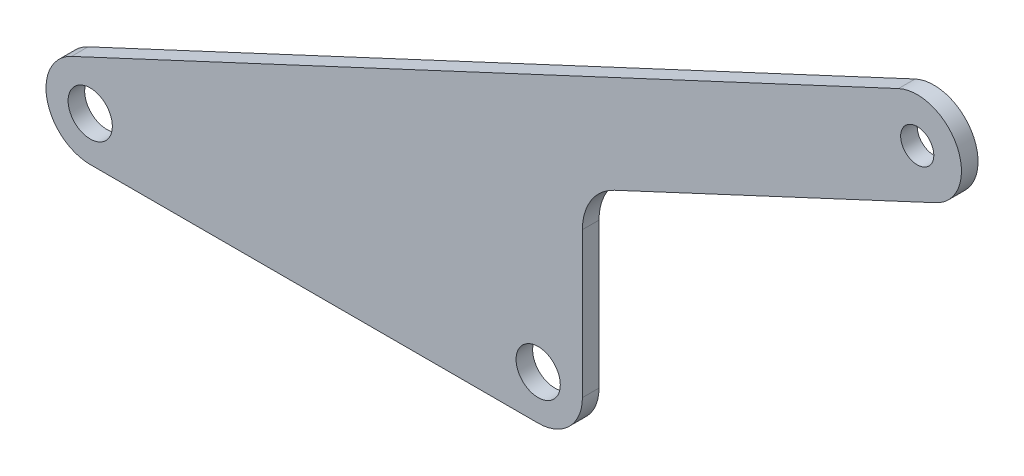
SolidWorks part; units mm, degrees
ref_plane "Plan de face" through (0, 0, 0) normal (0, 0, 1) x (1, 0, 0)
ref_plane "Plan de dessus" through (0, 0, 0) normal (0, 1, 0) x (1, 0, 0)
ref_plane "Plan de droite" through (0, 0, 0) normal (1, 0, 0) x (0, 0, -1)
sketch "Esquisse1" plane through (0, 0, 0) normal (0, 0, 1) x (1, 0, 0)
  line L0 (0, 0) -> (81, 0) construction
  line L1 (0, 0) -> (149.5408, 69.732) construction
  line L2 (0, 0) -> (149.5408, 69.732) construction
  line L3 (-3.3809, 7.2505) -> (146.1598, 76.9825)
  line L4 (94.7738, 35.3667) -> (152.9217, 62.4816)
  line L5 (0, 0) -> (81, 0) construction
  line L7 (0, -8) -> (81, -8)
  line L9 (89, 0) -> (89, 26.3037)
  circle A0 centre (0, 0) radius 4
  circle A1 centre (81, 0) radius 4
  arc A2 (-3.3809, 7.2505) -> (0, -8) centre (0, 0) ccw
  arc A3 (152.9217, 62.4816) -> (146.1598, 76.9825) centre (149.5408, 69.732) ccw
  arc A5 (81, -8) -> (89, 0) centre (81, 0) ccw
  arc A6 (89, 26.3037) -> (94.7738, 35.3667) centre (99, 26.3037) cw
  point P5 (113.2885, 52.8273)
  point P12 (35, 0)
  dimension "D1" = 8
  dimension "D2" = 8
  dimension "D5" = 8
  dimension "D7" = 8
  dimension "D8" = 8
  dimension "D10" = 10
  dimension "D3" = 81
  dimension "D4" = 165
  dimension "D6" = 25
  dimension "D9" = 8
  dimension "D11" = 8
  dimension "D12" = 8
extrude "Boss.-Extru.1" add sketch "Esquisse1" along normal blind 3
sketch "Esquisse2" plane through (0, 0, 3) normal (0, 0, 1) x (1, 0, 0)
  circle A0 centre (149.5408, 69.732) radius 3
  dimension "D1" = 6
extrude "Enlèv. mat.-Extru.1" cut sketch "Esquisse2" against normal through all
sketch "Esquisse6" plane through (0, 0, 0) normal (0, 0, -1) x (-1, 0, 0)
  line L0 (-12.6311, 1.7746) -> (-58.313, 2.9218) construction
  text T0 "<b>LEVIER 70mm</b>" font "Century Gothic" height in points 18
extrude "70" [suppressed] cut sketch "Esquisse6" against normal blind 1
sketch "Esquisse7" plane through (0, 0, 0) normal (0, 0, -1) x (-1, 0, 0)
  line L0 (-12.0243, 1.0084) -> (-62.2169, 2.2342) construction
  text T0 "<b>LEVIER 75mm</b>" font "Century Gothic" height in points 18
extrude "75" [suppressed] cut sketch "Esquisse7" against normal blind 1
sketch "Esquisse8" plane through (0, 0, 0) normal (0, 0, -1) x (-1, 0, 0)
  line L0 (-17.9101, 1.4472) -> (-67.7531, 1.4472) construction
  text T0 "<b>LEVIER 81mm</b>" font "Century Gothic" height in points 18
extrude "81" cut sketch "Esquisse8" against normal blind 1
